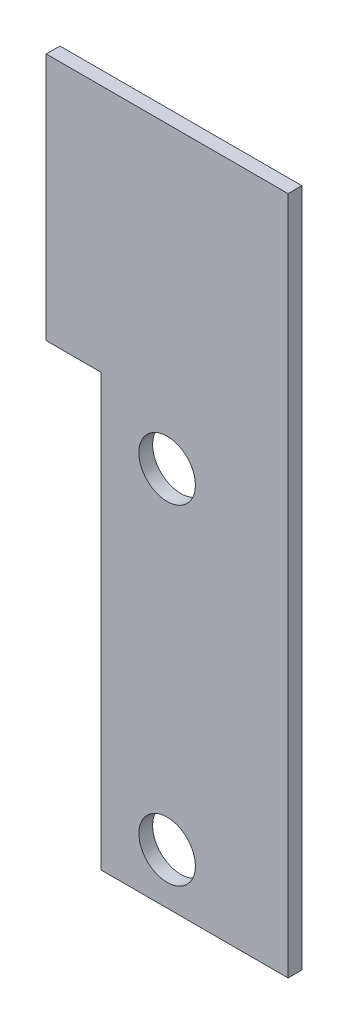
SolidWorks part; units mm, degrees
ref_plane "Front" through (0, 0, 0) normal (0, 0, 1) x (1, 0, 0)
ref_plane "Top" through (0, 0, 0) normal (0, 1, 0) x (1, 0, 0)
ref_plane "Right" through (0, 0, 0) normal (1, 0, 0) x (0, 0, -1)
sketch "Sketch1" plane through (0, 0, 0) normal (0, 0, 1) x (1, 0, 0)
  line L1 (-34.3452, 0) -> (34.3452, 0)
  line L2 (-34.3452, 0) -> (-34.3452, -75.2061)
  line L3 (-34.3452, -75.2061) -> (34.3452, -75.2061)
  line L4 (34.3452, 0) -> (34.3452, -75.2061)
extrude "Extrude1" add sketch "Sketch1" along normal blind 0.7937
sketch "Sketch2" plane through (0, 0, 0.7937) normal (0, 0, 1) x (1, 0, 0)
  line L0 (0, -39.2301) -> (-3.81, -39.2301)
  line L1 (-3.81, -39.2301) -> (-3.81, -14.3381)
  line L2 (-3.81, -14.3381) -> (-6.985, -14.3381)
  line L3 (-6.985, -14.3381) -> (-6.985, 0)
  line L4 (34.3452, 0) -> (-34.3452, 0) construction
  line L5 (-6.985, 0) -> (-34.3452, 0)
  line L6 (-34.3452, 0) -> (-34.3452, -75.2061)
  line L7 (-34.3452, -75.2061) -> (0, -75.2061)
  line L8 (-34.3452, -75.2061) -> (34.3452, -75.2061) construction
  line L9 (0, -75.2061) -> (0, -39.2301)
  line L10 (-3.175, -39.2301) -> (3.175, -39.2301) construction
  line L12 (-34.3452, 0) -> (-34.3452, -75.2061) construction
  line L13 (-3.175, -14.3381) -> (-3.175, -39.2301) construction
  line L14 (-3.175, -14.3381) -> (3.175, -14.3381) construction
  dimension "D1" = 0.635
  dimension "D2" = 6.985
extrude "Cut-Extrude1" cut sketch "Sketch2" against normal through all
hole_wizard "#30 (0.128500) Diameter Hole1" positions "Sketch4" profile "Sketch3" hole size "#30" standard "Ansi Inch"
sketch "Sketch4" plane through (0, 0, 0.7937) normal (0, 0, 1) x (1, 0, 0)
  circle A1 centre (0, -17.2591) radius 1.6319 construction
  circle A2 centre (0, -36.3091) radius 1.6319 construction
  point P0 (0, -17.2591)
  point P1 (0, -36.3091)
sketch "Sketch3" plane through (0, -17.2591, 0.7937) normal (1, 0, 0) x (0, -1, 0)
  line L0 (0, 0) -> (0, 0.7937)
  line L1 (0, 0.7937) -> (1.6319, 0.7937)
  line L2 (1.6319, 0.7937) -> (1.6319, 0)
  line L5 (1.6319, 0) -> (0, 0)
  line L11 (0, -6.35) -> (0, 107.95) construction
  dimension "Thru Hole Dia." = 3.2639
  dimension "Thru Hole Depth" = 0.7937
sketch "Sketch5" plane through (0, 0, 0.7937) normal (0, 0, 1) x (1, 0, 0)
  line L0 (0, -39.2301) -> (6.985, -39.2301)
  line L1 (6.985, -39.2301) -> (6.985, 0)
  line L2 (34.3452, 0) -> (-6.985, 0) construction
  line L3 (6.985, 0) -> (34.3452, 0)
  line L4 (34.3452, 0) -> (34.3452, -75.2061)
  line L5 (34.3452, -75.2061) -> (0, -75.2061)
  line L6 (0, -75.2061) -> (0, -39.2301)
  dimension "D1" = 6.985
extrude "Cut-Extrude2" cut sketch "Sketch5" against normal through all
